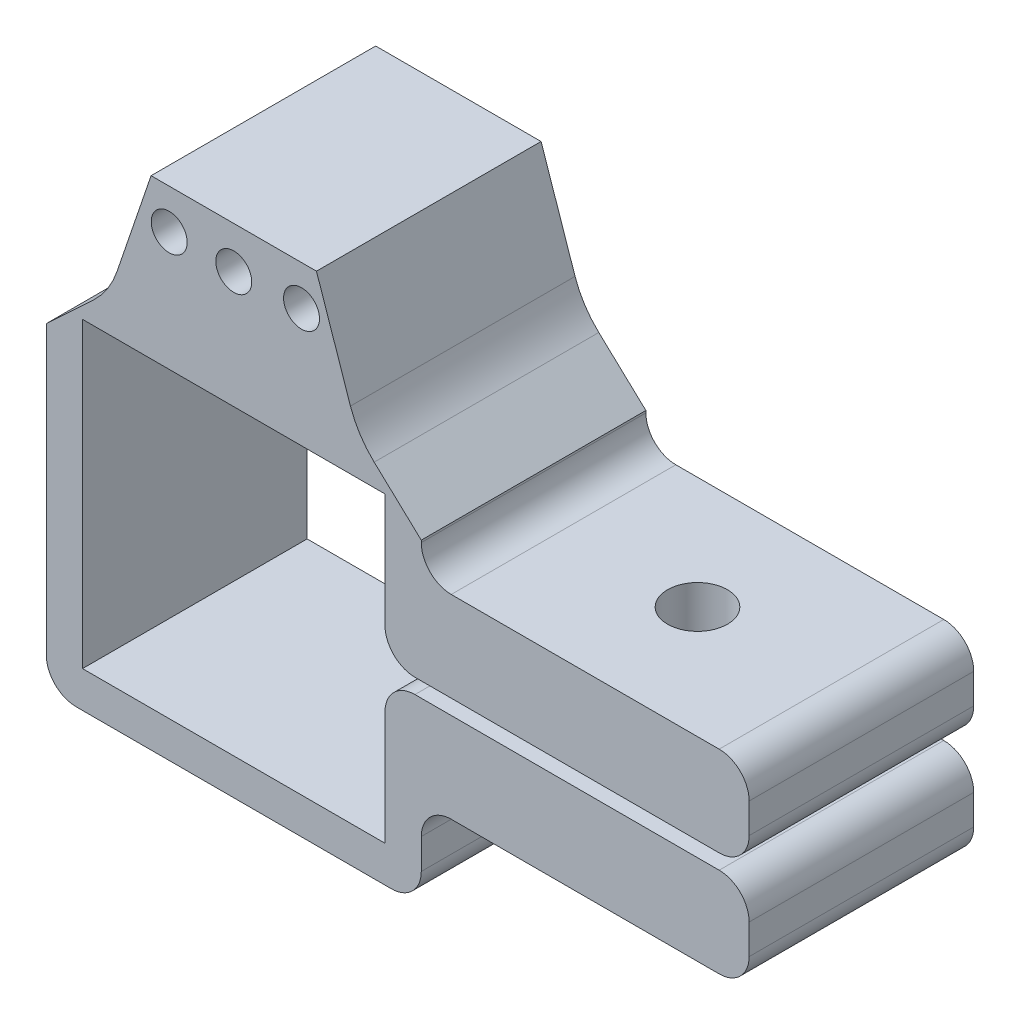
SolidWorks part; units mm, degrees
ref_plane "Front Plane" through (0, 0, 0) normal (0, 0, 1) x (1, 0, 0)
ref_plane "Top Plane" through (0, 0, 0) normal (0, 1, 0) x (1, 0, 0)
ref_plane "Right Plane" through (0, 0, 0) normal (1, 0, 0) x (0, 0, -1)
sketch "Sketch1" plane through (0, 0, 0) normal (0, 0, 1) x (1, 0, 0)
  line L0 (-237.4422, -7.4014) -> (-217.2422, -7.4014)
  line L1 (-217.2422, -7.4014) -> (-217.2422, 0.1986)
  line L2 (-217.2422, 12.7986) -> (-237.4422, 12.7986)
  line L3 (-237.4422, 12.7986) -> (-237.4422, -7.4014)
  line L4 (-216.8201, -9.8235) -> (-237.864, -9.8235)
  line L5 (-239.864, -7.8235) -> (-239.864, 16.3959)
  line L6 (-227.342, -9.8235) -> (-227.342, 24.8795) construction
  line L7 (-232.864, 23.3959) -> (-221.8201, 23.3959)
  line L8 (-214.8201, 16.3959) -> (-214.8201, 11.1986)
  line L9 (-212.8201, 9.1986) -> (-194.9258, 9.1986)
  line L10 (-192.9258, 7.1986) -> (-192.9258, 5.1986)
  line L11 (-194.9258, 3.1986) -> (-215.2422, 3.1986)
  line L12 (-214.8201, -7.8235) -> (-214.8201, -5.8014)
  line L13 (-212.8201, -3.8014) -> (-194.9258, -3.8014)
  line L14 (-192.9258, -1.8014) -> (-192.9258, 0.1986)
  line L15 (-194.9258, 2.1986) -> (-215.2422, 2.1986)
  line L16 (-217.2422, 5.1986) -> (-217.2422, 12.7986)
  circle A0 centre (-231.6545, 20.7423) radius 1.2
  circle A1 centre (-227.3422, 20.6078) radius 1.2
  circle A2 centre (-222.8173, 20.7423) radius 1.2
  arc A3 (-239.864, -7.8235) -> (-237.864, -9.8235) centre (-237.864, -7.8235) ccw
  arc A4 (-216.8201, -9.8235) -> (-214.8201, -7.8235) centre (-216.8201, -7.8235) ccw
  arc A5 (-194.9258, 9.1986) -> (-192.9258, 7.1986) centre (-194.9258, 7.1986) cw
  arc A6 (-192.9258, 5.1986) -> (-194.9258, 3.1986) centre (-194.9258, 5.1986) cw
  arc A7 (-194.9258, -3.8014) -> (-192.9258, -1.8014) centre (-194.9258, -1.8014) ccw
  arc A8 (-192.9258, 0.1986) -> (-194.9258, 2.1986) centre (-194.9258, 0.1986) ccw
  arc A9 (-217.2422, 0.1986) -> (-215.2422, 2.1986) centre (-215.2422, 0.1986) cw
  arc A10 (-215.2422, 3.1986) -> (-217.2422, 5.1986) centre (-215.2422, 5.1986) cw
  arc A11 (-214.8201, 16.3959) -> (-221.8201, 23.3959) centre (-221.8201, 16.3959) ccw
  arc A12 (-232.864, 23.3959) -> (-239.864, 16.3959) centre (-232.864, 16.3959) ccw
  arc A13 (-212.8201, 9.1986) -> (-214.8201, 11.1986) centre (-212.8201, 11.1986) cw
  arc A14 (-212.8201, -3.8014) -> (-214.8201, -5.8014) centre (-212.8201, -5.8014) ccw
  point P17 (-227.342, 23.3959)
  point P27 (-239.864, -9.8235)
  point P30 (-214.8201, -9.8235)
  point P35 (-192.9258, 3.1986)
  point P44 (-217.2422, 3.1986)
  point P47 (-214.8201, 23.3959)
  point P50 (-239.864, 23.3959)
  dimension "D1" = 2
  dimension "D2" = 2
  dimension "D3" = 7
  dimension "D4" = 2
  dimension "D5" = 2
extrude "Boss-Extrude1" add sketch "Sketch1" along normal blind 15
sketch "Sketch2" plane through (0, 9.1986, 0) normal (0, 1, 0) x (-1, 0, 0)
  line L0 (212.8201, 15) -> (194.9258, 0) construction
  line L1 (212.8201, 15) -> (212.8201, 0) construction
  line L2 (194.9258, 0) -> (212.8201, 0) construction
  line L3 (194.9258, 15) -> (194.9258, 0) construction
  circle A0 centre (203.8729, 7.5) radius 2
extrude "Cut-Extrude1" cut sketch "Sketch2" against normal blind 15
sketch "Sketch3" plane through (0, 0, 15) normal (0, 0, 1) x (1, 0, 0)
  line L0 (-232.864, 23.3959) -> (-235.1348, 16.7277)
  line L1 (-221.8201, 23.3959) -> (-219.5493, 16.7277)
  line L2 (-239.864, 16.3959) -> (-239.864, -7.8235) construction
  line L3 (-239.864, 12.4454) -> (-239.864, 23.3959)
  line L4 (-239.864, 23.3959) -> (-232.864, 23.3959)
  line L5 (-232.864, 23.3959) -> (-221.8201, 23.3959) construction
  line L6 (-227.342, 23.3959) -> (-227.342, 22.3022) construction
  line L7 (-214.8201, 11.3394) -> (-217.9652, 14.2771)
  line L8 (-239.864, 12.4454) -> (-239.864, 11.3394)
  line L9 (-214.8201, 11.3394) -> (-214.8201, 23.3959)
  line L10 (-214.8201, 23.3959) -> (-221.8201, 23.3959)
  line L12 (-239.864, 11.3394) -> (-236.7189, 14.2771)
  line L13 (-237.8591, 21.6442) -> (-237.8591, 12.78) construction
  line L14 (-237.8591, 12.78) -> (-240.8691, 12.78) construction
  arc A0 (-232.864, 23.3959) -> (-239.864, 16.3959) centre (-232.864, 16.3959) ccw construction
  arc A1 (-214.8201, 16.3959) -> (-221.8201, 23.3959) centre (-221.8201, 16.3959) ccw construction
  arc A2 (-236.7189, 14.2771) -> (-235.1348, 16.7277) centre (-240.8145, 18.6619) ccw
  arc A3 (-217.9652, 14.2771) -> (-219.5493, 16.7277) centre (-213.8696, 18.6619) cw
  point P24 (-235.6197, 15.3039)
  dimension "D1" = 6
extrude "Cut-Extrude4" cut sketch "Sketch3" against normal blind 15
